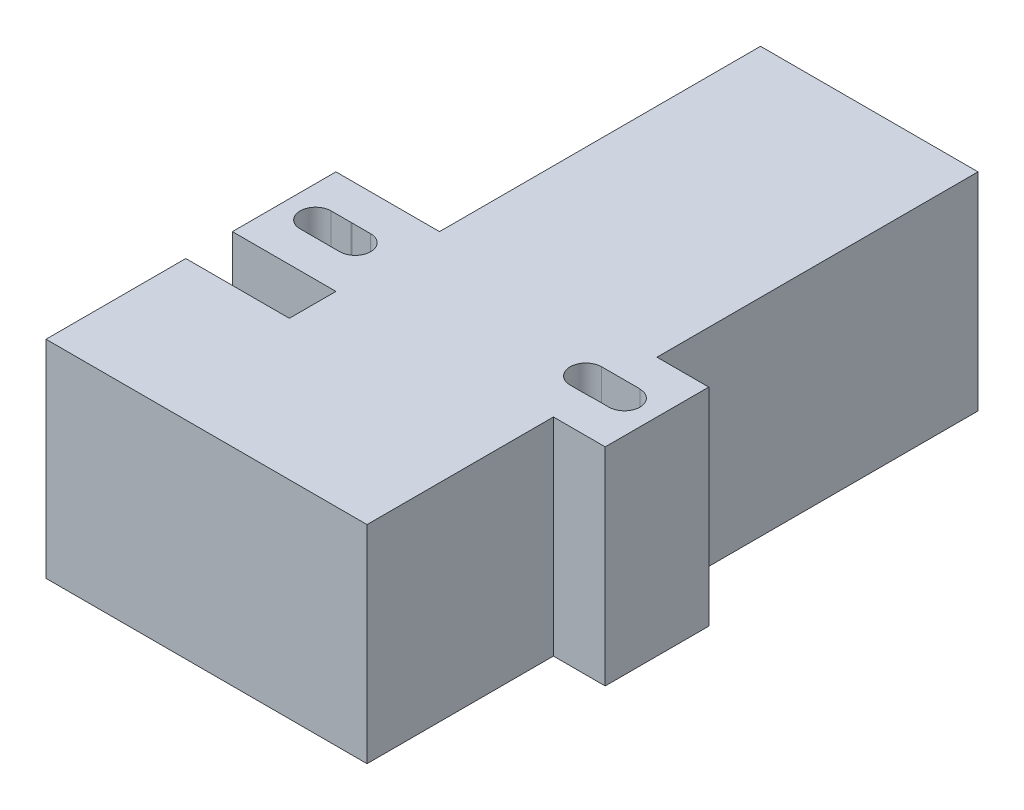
SolidWorks part; units mm, degrees
ref_plane "前视基准面" through (0, 0, 0) normal (0, 0, 1) x (1, 0, 0)
ref_plane "上视基准面" through (0, 0, 0) normal (0, 1, 0) x (1, 0, 0)
ref_plane "右视基准面" through (0, 0, 0) normal (1, 0, 0) x (0, 0, -1)
other "Configuration Table"
sketch "草图1" plane through (0, 0, 0) normal (0, 1, 0) x (1, 0, 0)
  line L1 (0, 0) -> (21, 0)
  line L2 (0, 0) -> (0, 59)
  line L3 (0, 59) -> (21, 59)
  line L4 (21, 0) -> (21, 59)
  dimension "D1" = 21
  dimension "D2" = 59
extrude "凸台-拉伸1" add sketch "草图1" along normal blind 20
sketch "草图2" plane through (0, 20, 0) normal (0, 1, 0) x (1, 0, 0)
  line L0 (0, 59) -> (21, 59)
  line L5 (-7.5, 18) -> (28.5, 18)
  line L6 (-7.5, 18) -> (-7.5, 28)
  line L7 (-7.5, 28) -> (28.5, 28)
  line L8 (28.5, 18) -> (28.5, 28)
  line L9 (-7.5, 18) -> (28.5, 28) construction
  line L10 (-7.5, 28) -> (28.5, 18) construction
  dimension "D4" = 10
extrude "凸台-拉伸2" add sketch "草图2" against normal blind 20 contours L7 L6 L5 M8 | L5 L8 L7 M10
sketch "草图3" plane through (0, 20, 0) normal (0, 1, 0) x (1, 0, 0)
  line L3 (21, 0) -> (-10, 0)
  line L4 (21, 0) -> (21, 13.5)
  line L5 (21, 13.5) -> (-10, 13.5)
  line L6 (-10, 0) -> (-10, 13.5)
  dimension "D1" = 31
extrude "凸台-拉伸4" add sketch "草图3" against normal blind 20
sketch "草图5" plane through (0, 20, 0) normal (0, 1, 0) x (1, 0, 0)
  line L1 (-7.5, 28) -> (-10, 28)
  line L2 (-7.5, 28) -> (-7.5, 18)
  line L3 (-7.5, 18) -> (-10, 18)
  line L4 (-10, 28) -> (-10, 18)
  dimension "D1" = 2.5
extrude "凸台-拉伸5" add sketch "草图5" against normal blind 20
sketch "草图6" plane through (0, 20, 0) normal (0, 1, 0) x (1, 0, 0)
  line L0 (21, 28) -> (28.5, 28) construction
  line L1 (28.5, 18) -> (26, 18)
  line L2 (28.5, 18) -> (28.5, 28)
  line L3 (28.5, 28) -> (26, 28)
  line L4 (26, 18) -> (26, 28)
  dimension "D1" = 2.5
extrude "切除-拉伸1" cut sketch "草图6" against normal blind 20
sketch "草图7" plane through (0, 20, 0) normal (0, 1, 0) x (1, 0, 0)
  line L1 (-10, 28) -> (26, 28)
  line L2 (-10, 28) -> (-10, 18)
  line L3 (-10, 18) -> (26, 18)
  line L4 (26, 28) -> (26, 18)
  circle A0 centre (-5, 23) radius 1.5
  circle A1 centre (21, 23) radius 1.5
extrude "切除-拉伸2" cut sketch "草图7" against normal blind 20 contours A0 | A1
sketch "草图9" plane through (0, 20, 0) normal (0, 1, 0) x (1, 0, 0)
  line L0 (21, 23) -> (22.8582, 23) construction
  line L1 (21, 24.4997) -> (22.8582, 24.4997)
  line L2 (21, 21.5003) -> (22.8582, 21.5003)
  line L3 (21, 23) -> (19.1365, 23) construction
  line L4 (21, 21.4735) -> (19.1365, 21.4735)
  line L5 (21, 24.5265) -> (19.1365, 24.5265)
  line L6 (-5, 23) -> (-3.1404, 23) construction
  line L7 (-5, 24.4997) -> (-3.1404, 24.4997)
  line L8 (-5, 21.5003) -> (-3.1404, 21.5003)
  line L9 (-5, 23) -> (-6.9651, 23) construction
  line L10 (-5, 21.5003) -> (-6.9651, 21.5003)
  line L11 (-5, 24.4997) -> (-6.9651, 24.4997)
  arc A0 (21, 24.4997) -> (21, 21.5003) centre (21, 23) ccw
  arc A1 (22.8582, 21.5003) -> (22.8582, 24.4997) centre (22.8582, 23) ccw
  arc A2 (21, 21.4735) -> (21, 24.5265) centre (21, 23) ccw
  arc A3 (19.1365, 24.5265) -> (19.1365, 21.4735) centre (19.1365, 23) ccw
  arc A4 (-5, 24.4997) -> (-5, 21.5003) centre (-5, 23) ccw
  arc A5 (-3.1404, 21.5003) -> (-3.1404, 24.4997) centre (-3.1404, 23) ccw
  arc A6 (-5, 21.5003) -> (-5, 24.4997) centre (-5, 23) ccw
  arc A7 (-6.9651, 24.4997) -> (-6.9651, 21.5003) centre (-6.9651, 23) ccw
  point P3 (21.9291, 23)
  point P8 (20.0682, 23)
  point P17 (-4.0702, 23)
  point P23 (-5.9826, 23)
extrude "切除-拉伸3" cut sketch "草图9" against normal blind 20 contours L11 A7 L10 M9 | A2 L2 A1 L1 | L5 A3 L4 A2 L2 L1 M10 | A5 L7 A4 L8
sketch "草图10" plane through (0, 20, 0) normal (0, 1, 0) x (1, 0, 0)
  line L0 (21, 24.5265) -> (19.1365, 24.5265) construction
  line L1 (22.8582, 21.5003) -> (20.0682, 21.5003)
  line L2 (22.8582, 21.5003) -> (22.8582, 24.5265)
  line L3 (22.8582, 24.5265) -> (20.0682, 24.5265)
  line L4 (20.0682, 21.5003) -> (20.0682, 24.5265)
extrude "切除-拉伸4" cut sketch "草图10" against normal blind 21
